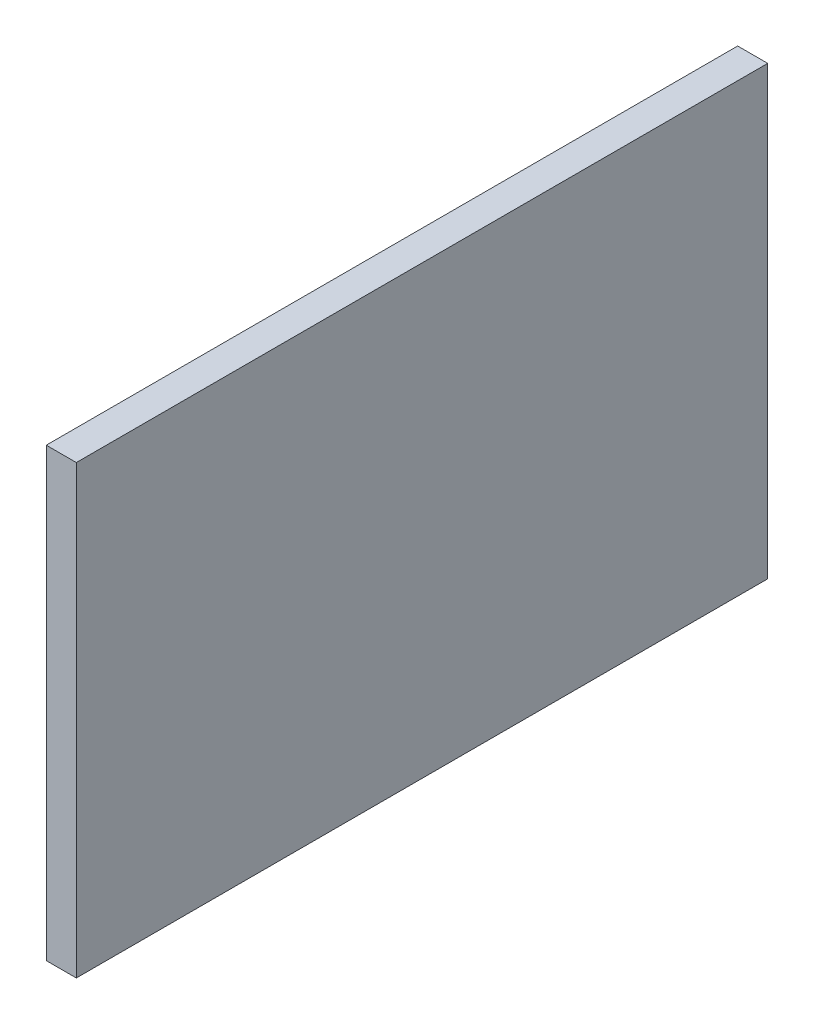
SolidWorks part; units mm, degrees
ref_plane "Alzado" through (0, 0, 0) normal (0, 0, 1) x (1, 0, 0)
ref_plane "Planta" through (0, 0, 0) normal (0, 1, 0) x (1, 0, 0)
ref_plane "Vista lateral" through (0, 0, 0) normal (1, 0, 0) x (0, 0, -1)
sketch "Croquis1" plane through (0, 0, 0) normal (1, 0, 0) x (0, 0, -1)
  line L1 (0, 0) -> (920, 0)
  line L2 (0, 0) -> (0, 594)
  line L3 (0, 594) -> (920, 594)
  line L4 (920, 0) -> (920, 594)
  dimension "D1" = 594
  dimension "D2" = 920
extrude "Saliente-Extruir1" add sketch "Croquis1" along normal blind 40
